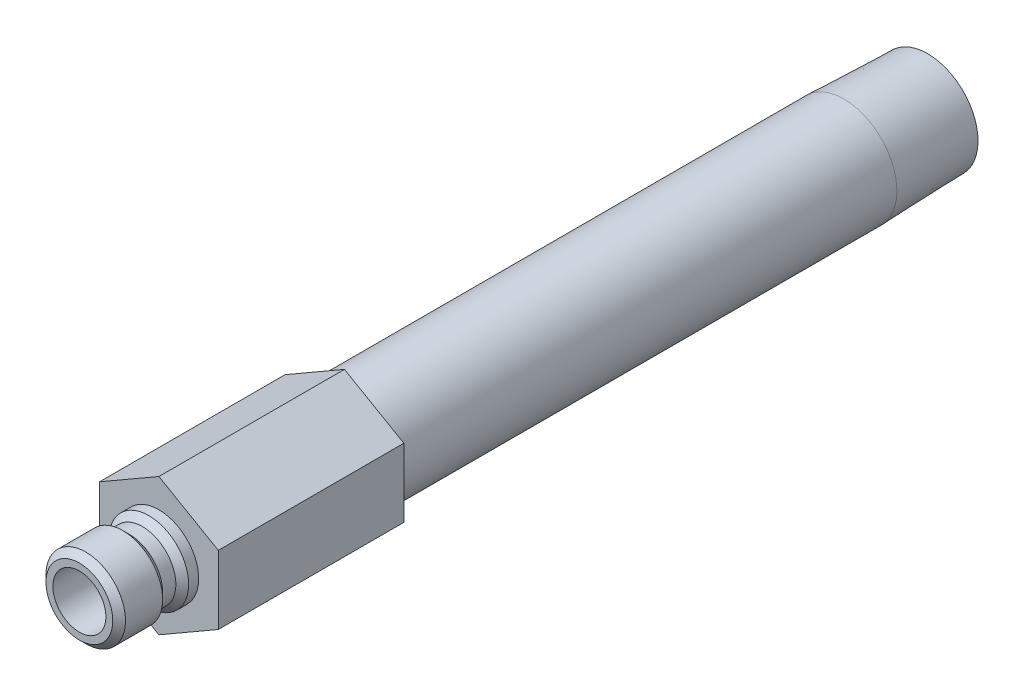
SolidWorks part; units mm, degrees
ref_plane "Front Plane" through (0, 0, 0) normal (0, 0, 1) x (1, 0, 0)
ref_plane "Top Plane" through (0, 0, 0) normal (0, 1, 0) x (1, 0, 0)
ref_plane "Right Plane" through (0, 0, 0) normal (1, 0, 0) x (0, 0, -1)
sketch "Sketch1" plane through (0, 0, 0) normal (1, 0, 0) x (0, 0, -1)
  line L0 (0, 0) -> (-12.7, 0) construction
  line L1 (-9.525, 3.175) -> (-9.525, 4.0005)
  line L2 (-3.556, 4.0005) -> (-3.556, 0) construction
  line L3 (-8.763, 4.7625) -> (-4.318, 4.7625)
  line L4 (0, 6.35) -> (0, 0) construction
  line L5 (-3.556, 4.0005) -> (-1.9685, 4.0005)
  line L6 (-1.2065, 4.7625) -> (0, 4.7625)
  line L7 (0, 4.7625) -> (0, 6.35)
  line L8 (-3.556, 4.0005) -> (-4.318, 4.7625)
  line L9 (-1.9685, 4.0005) -> (-1.2065, 4.7625)
  line L10 (-9.525, 4.0005) -> (-8.763, 4.7625)
  line L11 (22.225, 4.6228) -> (92.075, 4.6228)
  line L12 (0, 6.35) -> (82.042, 6.35)
  line L13 (82.042, 6.35) -> (92.075, 6.0365)
  line L14 (92.075, 6.0365) -> (92.075, 4.6228)
  line L15 (0, 0) -> (22.225, 0) construction
  line L16 (22.225, 0) -> (22.225, 4.7625) construction
  line L17 (22.225, 4.7625) -> (0, 4.7625) construction
  line L18 (22.225, 4.6228) -> (22.225, 3.175)
  line L19 (22.225, 3.175) -> (-9.525, 3.175)
  dimension "D1" = 9.525
  dimension "D2" = 1.5875
  dimension "D3" = 0.762
  dimension "D4" = 45
  dimension "D5" = 5.969
  dimension "D6" = 45
  dimension "D7" = 1.79
  dimension "D8" = 10.033
  dimension "D9" = 101.6
  dimension "D10" = 3.175
  dimension "D11" = 31.75
  dimension "D12" = 9.2456
  dimension "D13" = 6.35
  dimension "D14" = 9.525
  dimension "D15" = 12.7
revolve "Revolve1" add sketch "Sketch1" angle 360 about L0
sketch "Sketch2" plane through (0, 0, 0) normal (0, 0, 1) x (1, 0, 0)
  line L1 (-7.112, 4.1061) -> (-7.112, -4.1061)
  line L2 (-7.112, -4.1061) -> (0, -8.2122)
  line L3 (0, -8.2122) -> (7.112, -4.1061)
  line L4 (7.112, -4.1061) -> (7.112, 4.1061)
  line L5 (7.112, 4.1061) -> (0, 8.2122)
  line L6 (0, 8.2122) -> (-7.112, 4.1061)
  circle A0 centre (0, 0) radius 7.112 construction
  circle A1 centre (0, 0) radius 3.175 construction
  circle A2 centre (0, 0) radius 3.175
  dimension "D1" = 14.224
extrude "Boss-Extrude1" add sketch "Sketch2" against normal up to vertex (22.225 mm away) from vertex at 0
